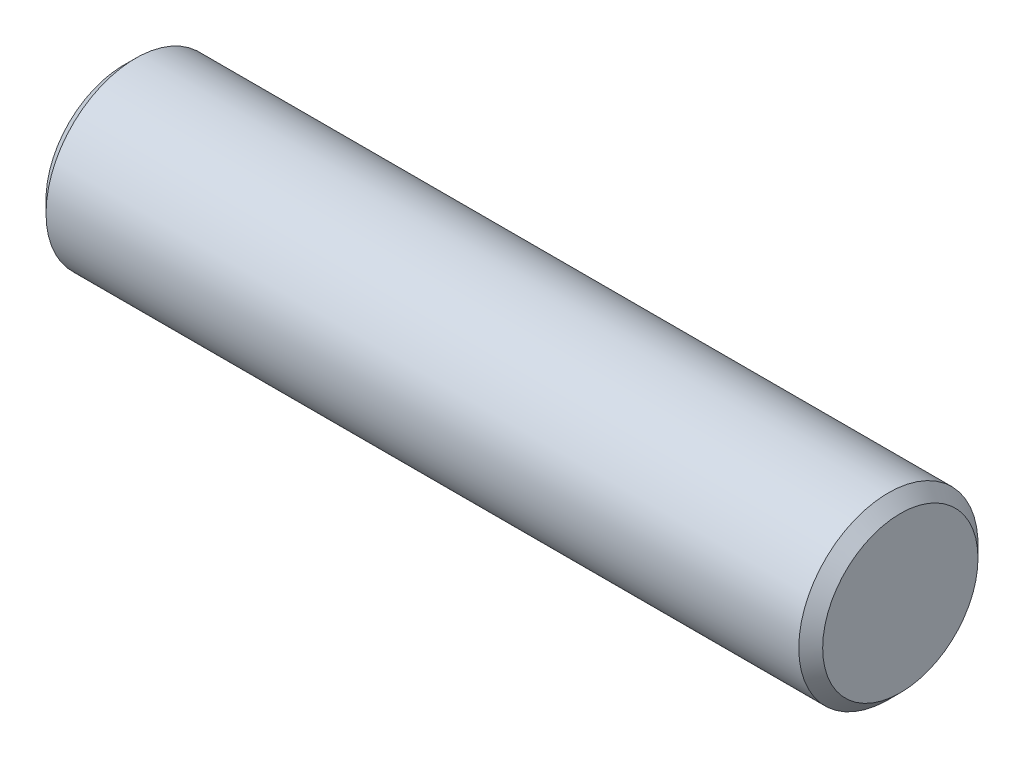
SolidWorks part; units mm, degrees
ref_plane "Front Plane" through (0, 0, 0) normal (0, 0, 1) x (1, 0, 0)
ref_plane "Top Plane" through (0, 0, 0) normal (0, 1, 0) x (1, 0, 0)
ref_plane "Right Plane" through (0, 0, 0) normal (1, 0, 0) x (0, 0, -1)
sketch "Sketch1" plane through (0, 0, 0) normal (1, 0, 0) x (0, 0, -1)
  circle A0 centre (0, 0) radius 0.75
extrude "Boss-Extrude1" add sketch "Sketch1" along normal blind 6.5
chamfer "Chamfer1" distance 0.1 angle 45 2 edges at (0, 0, -0.75) (6.5, 0, -0.75)
